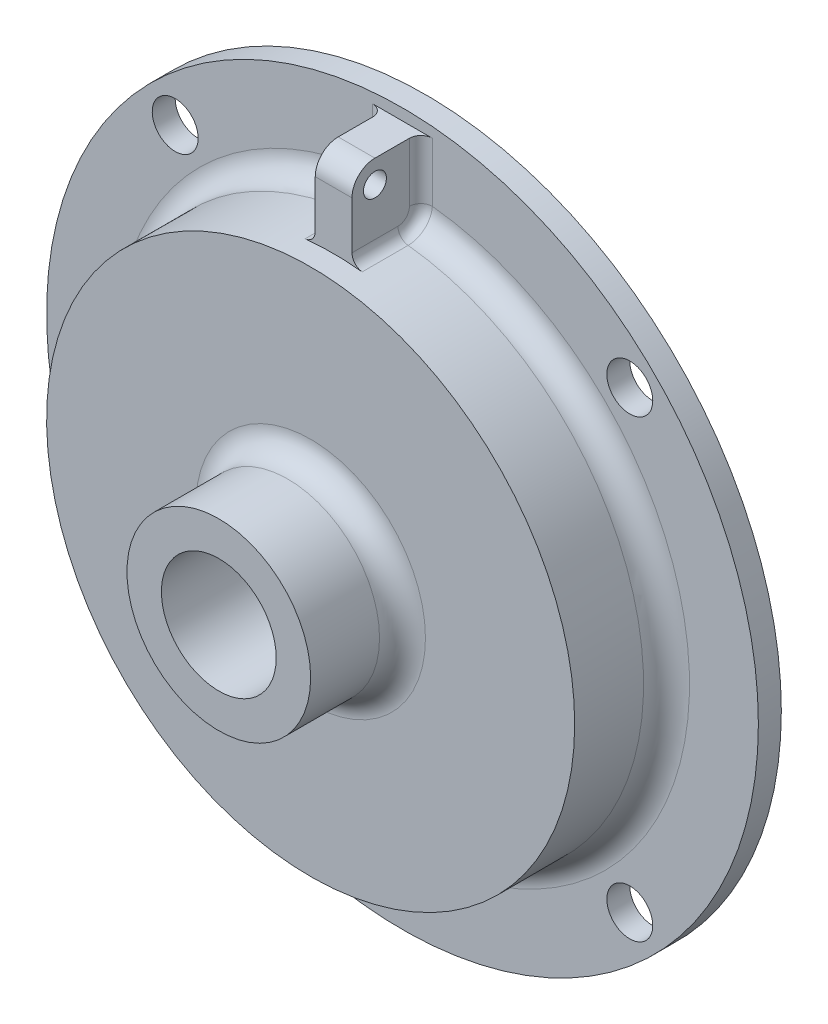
SolidWorks part; units mm, degrees
ref_plane "Front" through (0, 0, 0) normal (0, 0, 1) x (1, 0, 0)
ref_plane "Top" through (0, 0, 0) normal (0, 1, 0) x (1, 0, 0)
ref_plane "Right" through (0, 0, 0) normal (1, 0, 0) x (0, 0, -1)
sketch "Sketch1"
  dimension "D1" = 98.425
extrude "Base-Extrude" add sketch "Sketch1" along normal blind 3.175
sketch "Sketch5"
  dimension "D1" = 88.9
  dimension "D2" = 6.35
  dimension "D3" = 45
extrude "Cut-Extrude2" cut sketch "Sketch5" against normal through all
pattern_circular "CirPattern1" count 4 every 90 about axis through (0, 0, 0) along (0, 0, 1) of "Cut-Extrude2"
sketch "Sketch2"
  dimension "D1" = 73.025
extrude "Boss-Extrude1" add sketch "Sketch2" along normal blind 12.7
sketch "Sketch3"
  dimension "D1" = 25.4
extrude "Boss-Extrude2" add sketch "Sketch3" along normal blind 12.7
fillet "Fillet1" radius 3.175 2 edges at (36.5125, 0, 3.175) (12.7, 0, 15.875)
sketch "Sketch6"
  dimension "D1" = 5.08
  dimension "D2" = 9.525
extrude "Boss-Extrude3" add sketch "Sketch6" along normal blind 47.625
sketch "Sketch4"
  dimension "D1" = 15.875
extrude "Cut-Extrude1" cut sketch "Sketch4" against normal through all
fillet "Fillet2" radius 3.175 1 edges at (0, 47.625, 12.7)
sketch "Sketch7"
  dimension "D1" = 3.175
extrude "Cut-Extrude3" cut sketch "Sketch7" against normal up to next
fillet "Fillet3" radius 1.5875 6 edges at (2.54, 41.6917, 8.7475) (-2.54, 41.6917, 8.7475) (2.54, 43.6156, 3.175) (-2.54, 36.424, 9.525) (-2.54, 43.6156, 3.175) (2.54, 36.424, 9.525)
